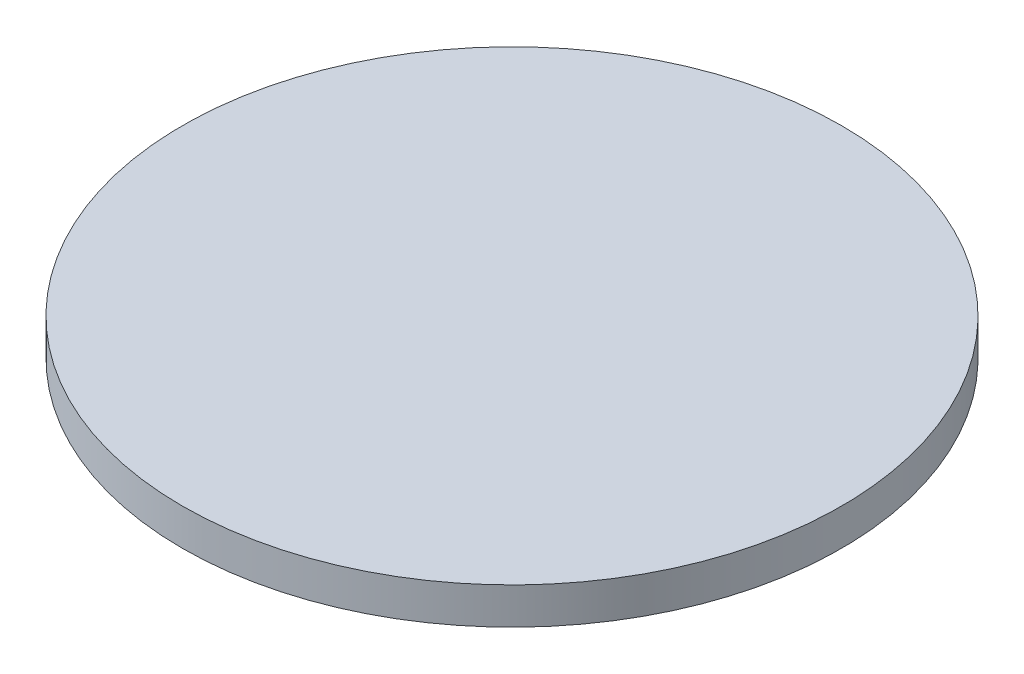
SolidWorks part; units mm, degrees
ref_plane "前视基准面" through (0, 0, 0) normal (0, 0, 1) x (1, 0, 0)
ref_plane "上视基准面" through (0, 0, 0) normal (0, 1, 0) x (1, 0, 0)
ref_plane "右视基准面" through (0, 0, 0) normal (1, 0, 0) x (0, 0, -1)
other "Configuration Table"
sketch "草图1" plane through (0, 0, 0) normal (0, 1, 0) x (1, 0, 0)
  circle A0 centre (0, 0) radius 45
  dimension "D1" = 90
extrude "凸台-拉伸1" add sketch "草图1" along normal blind 5
